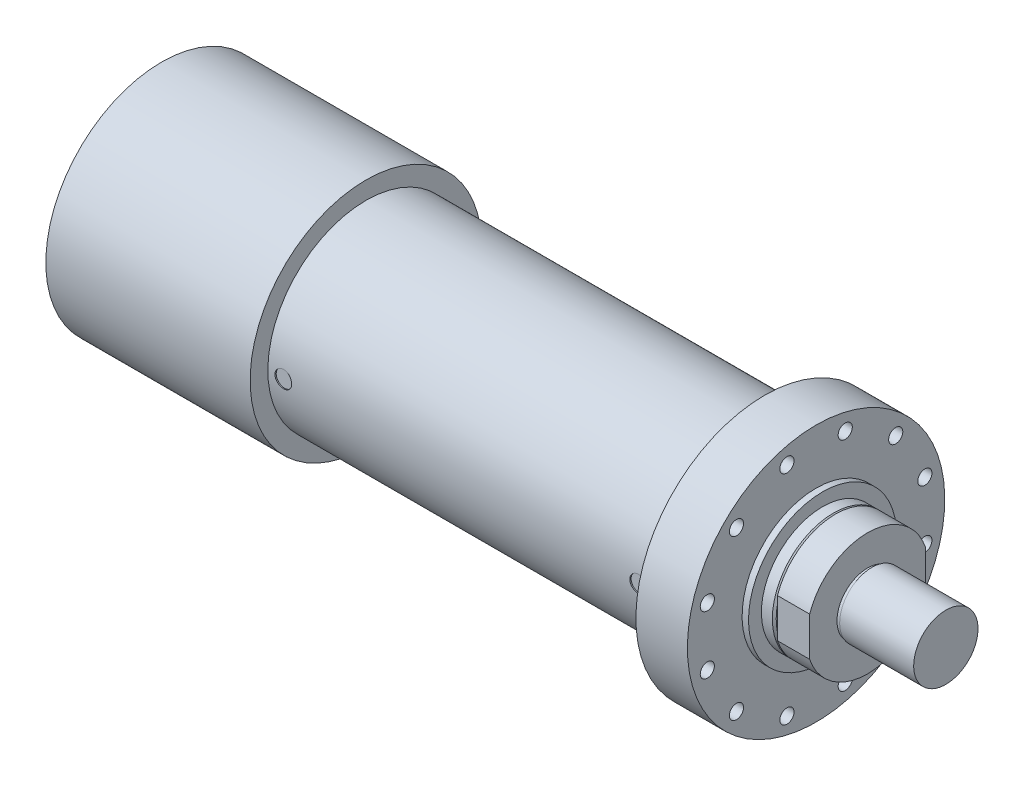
SolidWorks part; units mm, degrees
ref_plane "前视基准面" through (0, 0, 0) normal (0, 0, 1) x (1, 0, 0)
ref_plane "上视基准面" through (0, 0, 0) normal (0, 1, 0) x (1, 0, 0)
ref_plane "右视基准面" through (0, 0, 0) normal (1, 0, 0) x (0, 0, -1)
sketch "草图2" plane through (0, 0, 0) normal (0, 0, 1) x (1, 0, 0)
  line L0 (0, 0) -> (0, 152.5)
  line L1 (0, 152.5) -> (619.5, 152.5)
  line L6 (619.5, 152.5) -> (619.5, 0)
  line L7 (619.5, 0) -> (0, 0)
  dimension "D1" = 152.5
  dimension "D4" = 619.5
revolve "旋转1" add sketch "草图2" angle 360 about L7
sketch "草图3" plane through (619.5, 0, 0) normal (1, 0, 0) x (0, 0, -1)
  line L0 (0, 0) -> (232.7364, 0) construction
  line L1 (0, 0) -> (226.3775, 60.6577) construction
  circle A0 centre (0, 0) radius 200
  circle A1 centre (0, 0) radius 175 construction
  circle A2 centre (169.037, 45.2933) radius 11
  circle A3 centre (169.037, -45.2933) radius 11
  circle A4 centre (123.7437, -123.7437) radius 11
  circle A5 centre (45.2933, -169.037) radius 11
  circle A6 centre (-45.2933, -169.037) radius 11
  circle A7 centre (-123.7437, -123.7437) radius 11
  circle A8 centre (-169.037, -45.2933) radius 11
  circle A9 centre (-169.037, 45.2933) radius 11
  circle A10 centre (-123.7437, 123.7437) radius 11
  circle A11 centre (-45.2933, 169.037) radius 11
  circle A12 centre (45.2933, 169.037) radius 11
  circle A13 centre (123.7437, 123.7437) radius 11
  point P32 (0, 0)
  dimension "D1" = 400
  dimension "D2" = 350
  dimension "D4" = 22
  dimension "D3" = 15
  dimension "D5" = 12
extrude "凸台-拉伸1" add sketch "草图3" along normal blind 80
sketch "草图4" plane through (699.5, 0, 0) normal (1, 0, 0) x (0, 0, -1)
  circle A0 centre (0, 0) radius 115
  dimension "D1" = 230
extrude "凸台-拉伸2" add sketch "草图4" along normal blind 10
sketch "草图5" plane through (709.5, 0, 0) normal (1, 0, 0) x (0, 0, -1)
  circle A0 centre (0, 0) radius 95
  dimension "D1" = 190
extrude "凸台-拉伸3" add sketch "草图5" along normal blind 20
chamfer "倒角1" distance 3 angle 45 1 edges at (729.5, 95, 0)
ref_plane "基准面1" through (0, 0, 152.5) normal (0, 0, 1) x (1, 0, 0)
ref_plane "基准面2" through (0, 0, -152.5) normal (0, 0, 1) x (1, 0, 0)
sketch "草图17" plane through (0, 0, -152.5) normal (0, 0, 1) x (1, 0, 0)
  circle A0 centre (44, 0) radius 13
  dimension "D1" = 26
  dimension "D2" = 44
extrude "切除-拉伸6" cut sketch "草图17" along normal blind 2
sketch "草图19" plane through (0, 0, 152.5) normal (0, 0, 1) x (1, 0, 0)
  line L0 (619.5, 200) -> (619.5, -200) construction
  circle A0 centre (24, 0) radius 13
  circle A1 centre (575.5, 0) radius 13
  dimension "D1" = 24
  dimension "D2" = 26
  dimension "D3" = 26
  dimension "D4" = 44
extrude "切除-拉伸7" cut sketch "草图19" against normal blind 2
sketch "草图23" plane through (0, 0, 0) normal (-1, 0, 0) x (0, 0, 1)
  circle A0 centre (0, 0) radius 180
  dimension "D1" = 360
extrude "凸台-拉伸8" add sketch "草图23" along normal blind 317.5
sketch "草图24" plane through (729.5, 0, 0) normal (1, 0, 0) x (0, 0, -1)
  line L2 (-90, 30.4138) -> (-90, -30.4138)
  line L4 (90, 30.4138) -> (90, -30.4138)
  line L5 (-58.2393, 75.0546) -> (58.2393, -75.0546) construction
  line L6 (-58.2393, -75.0546) -> (58.2393, 75.0546) construction
  arc A0 (-90, -30.4138) -> (90, -30.4138) centre (0, 0) ccw
  arc A1 (90, 30.4138) -> (-90, 30.4138) centre (0, 0) ccw
  dimension "D1" = 190
extrude "凸台-拉伸9" add sketch "草图24" along normal blind 50
sketch "草图25" plane through (779.5, 0, 0) normal (1, 0, 0) x (0, 0, -1)
  circle A0 centre (0, 0) radius 47.5
  dimension "D1" = 95
extrude "凸台-拉伸10" add sketch "草图25" along normal blind 5
sketch "草图26" plane through (784.5, 0, 0) normal (1, 0, 0) x (0, 0, -1)
  circle A0 centre (1.644, 0) radius 50
  dimension "D1" = 100
extrude "凸台-拉伸11" add sketch "草图26" along normal blind 115
